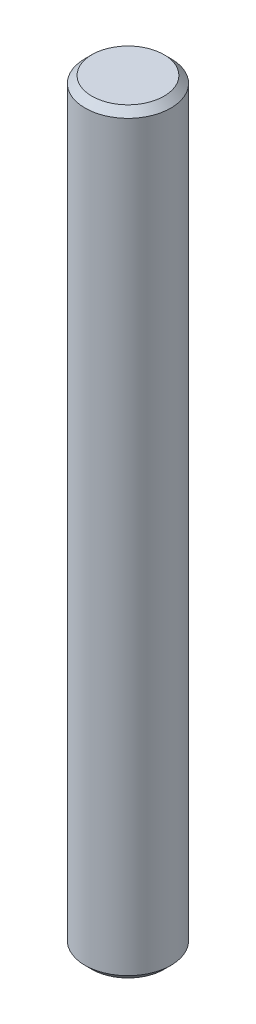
SolidWorks part; units mm, degrees
ref_plane "Front/Back" through (0, 0, 0) normal (0, 0, 1) x (1, 0, 0)
ref_plane "Top/Bottom" through (0, 0, 0) normal (0, 1, 0) x (1, 0, 0)
ref_plane "Right/Left" through (0, 0, 0) normal (1, 0, 0) x (0, 0, -1)
sketch "Sketch1" plane through (0, 0, 0) normal (0, 1, 0) x (1, 0, 0)
  circle A0 centre (0, 0) radius 1.5875
  dimension "D1" = 3.175
extrude "Extrude1" add sketch "Sketch1" along normal mid plane 27.9908
chamfer "Chamfer1" distance 0.254 angle 45
